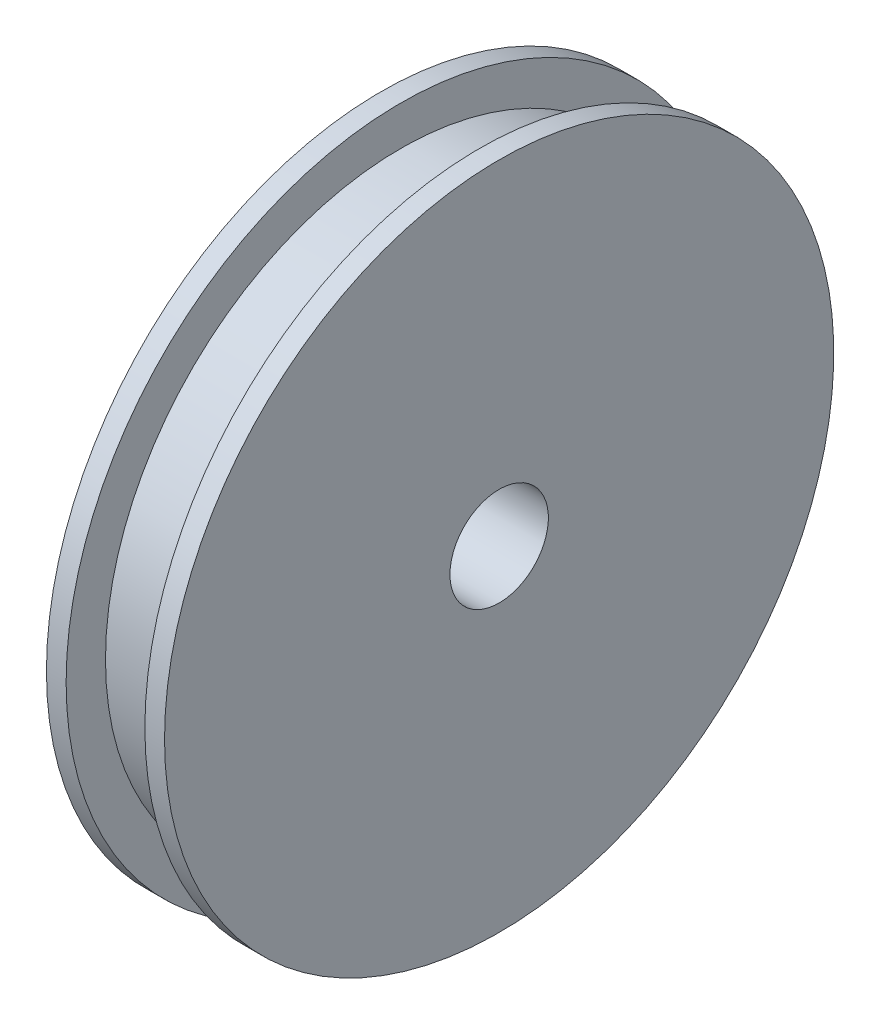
SolidWorks part; units mm, degrees
ref_plane "前视基准面" through (0, 0, 0) normal (0, 0, 1) x (1, 0, 0)
ref_plane "上视基准面" through (0, 0, 0) normal (0, 1, 0) x (1, 0, 0)
ref_plane "右视基准面" through (0, 0, 0) normal (1, 0, 0) x (0, 0, -1)
sketch "草图1" plane through (0, 0, 0) normal (1, 0, 0) x (0, 0, -1)
  circle A0 centre (0, 0) radius 15
  dimension "D1" = 30
extrude "凸台-拉伸1" add sketch "草图1" along normal mid plane 6
sketch "草图2" plane through (-3, 0, 0) normal (-1, 0, 0) x (0, 0, 1)
  circle A0 centre (0, 0) radius 17
  dimension "D1" = 34
extrude "凸台-拉伸2" add sketch "草图2" against normal blind 1
mirror "镜向1" about plane through (0, 0, 0) normal (1, 0, 0) of "凸台-拉伸2"
sketch "草图3" plane through (-3, 0, 0) normal (-1, 0, 0) x (0, 0, 1)
  circle A0 centre (0, 0) radius 3.25
  dimension "D1" = 6.5
extrude "凸台-拉伸3" add sketch "草图3" along normal blind 3
sketch "草图4" plane through (-6, 0, 0) normal (-1, 0, 0) x (0, 0, 1)
  circle A0 centre (0, 0) radius 2.5
  dimension "D1" = 5
extrude "切除-拉伸1" cut sketch "草图4" against normal through all contours A0
sketch "草图5" plane through (-3, 0, 0) normal (-1, 0, 0) x (0, 0, 1)
  circle A0 centre (0, 0) radius 1.75
  circle A1 centre (0, 0) radius 2.5 construction
  circle A2 centre (0, 0) radius 2.5
  dimension "D1" = 3.5
extrude "凸台-拉伸4" add sketch "草图5" against normal blind 1
